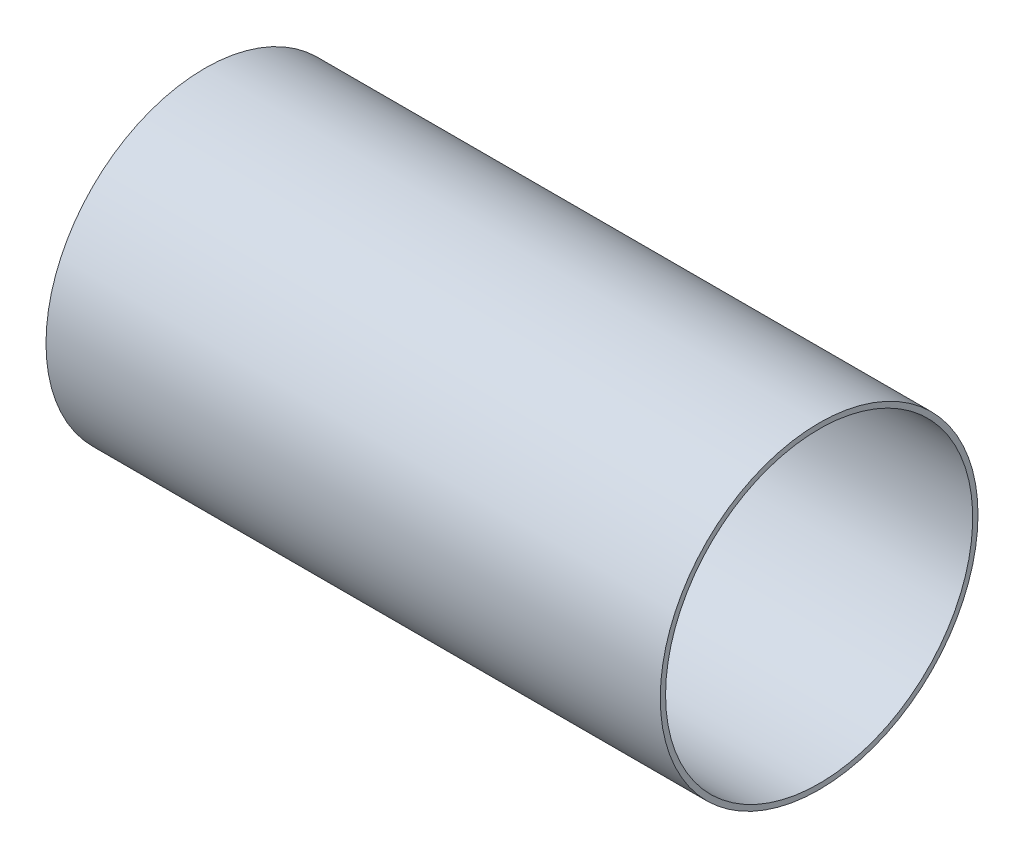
SolidWorks part; units mm, degrees
ref_plane "Face" through (0, 0, 0) normal (0, 0, 1) x (1, 0, 0)
ref_plane "Dessus" through (0, 0, 0) normal (0, 1, 0) x (1, 0, 0)
ref_plane "Droite" through (0, 0, 0) normal (1, 0, 0) x (0, 0, -1)
sketch "Esquisse1" plane through (0, 0, 0) normal (0, 0, 1) x (1, 0, 0)
  line L0 (0, 0) -> (16, 0) construction
  line L1 (0, 3) -> (11.6, 3)
  line L2 (0, 3) -> (0, 0.8)
  line L3 (0, 0.8) -> (0.8, 0.8)
  dimension "D1" = 3
  dimension "D3" = 0.8
  dimension "D4" = 0.8
  dimension "D5" = 11.6
revolve "Révol.-Mince1" add sketch "Esquisse1" angle 360 about L0
